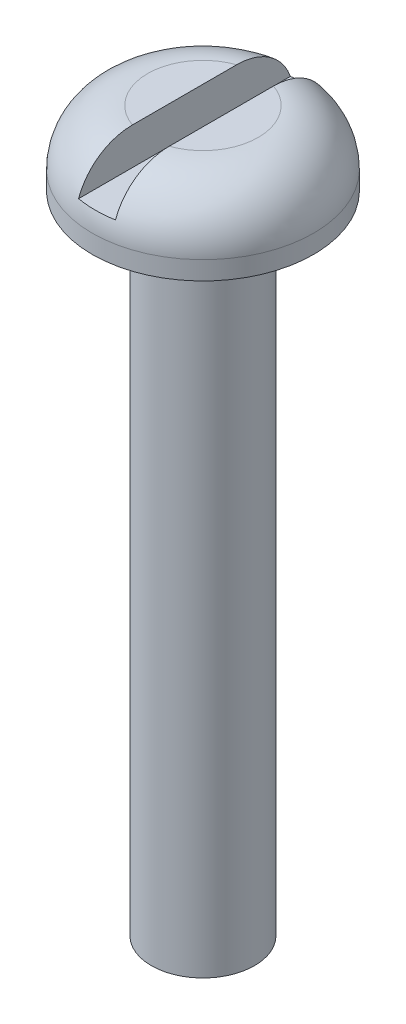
SolidWorks part; units mm, degrees
ref_plane "Plan de face" through (0, 0, 0) normal (0, 0, 1) x (1, 0, 0)
ref_plane "Plan de dessus" through (0, 0, 0) normal (0, 1, 0) x (1, 0, 0)
ref_plane "Plan de droite" through (0, 0, 0) normal (1, 0, 0) x (0, 0, -1)
ref_plane "Plan3" through (0, 6.4, 0) normal (0, 1, 0) x (-1, 0, 0)
sketch "Esquisse1" plane through (0, 6.4, 0) normal (0, 1, 0) x (-1, 0, 0)
  circle A0 centre (0, 0) radius 2.8
extrude "Extrusion1" add sketch "Esquisse1" against normal blind 35
sketch "Esquisse2" plane through (0, 0, 0) normal (0, 0, 1) x (1, 0, 0)
  line L0 (-8, 6.4) -> (8, 6.4) construction
  line L1 (0, 12) -> (0, 4.7448) construction
  line L2 (-8, 10.4) -> (8, 10.4) construction
  line L3 (-6, 11) -> (-6, 5.3938) construction
  line L4 (6, 11.3051) -> (6, 5.5838) construction
  line L6 (-3, 10.4) -> (0, 10.4)
  line L7 (-6, 7.4) -> (-6, 6.4)
  line L8 (-6, 6.4) -> (0, 6.4)
  line L9 (0, 10.4) -> (0, 6.4)
  arc A0 (-3, 10.4) -> (-6, 7.4) centre (-3, 7.4) ccw
  point P17 (-6, 10.4)
  point P21 (0, 6.4)
  dimension "D1" = 3
revolve "Révolution1" add sketch "Esquisse2" angle 360 about L1
sketch "Esquisse3" plane through (0, 0, 0) normal (0, 0, 1) x (1, 0, 0)
  line L0 (0, 9.9885) -> (0, 5.1977) construction
  line L2 (-3.6691, 0) -> (6.2564, 0) construction
  line L3 (-1, 11.0476) -> (-1, 5.7428) construction
  line L4 (1, 11) -> (1, 5.7428) construction
  line L5 (-1, 8.3952) -> (1, 8.3952)
  line L6 (-2.5295, 8.4) -> (1.4809, 8.4) construction
  line L7 (-1, 8.3952) -> (-1, 10.7503)
  line L8 (-1, 10.7503) -> (1, 10.7503)
  line L9 (1, 8.3952) -> (1, 10.7503)
  point P19 (0, 7.5787)
extrude "Enlèv. mat.-Extru.1" cut sketch "Esquisse3" against normal mid plane 13
